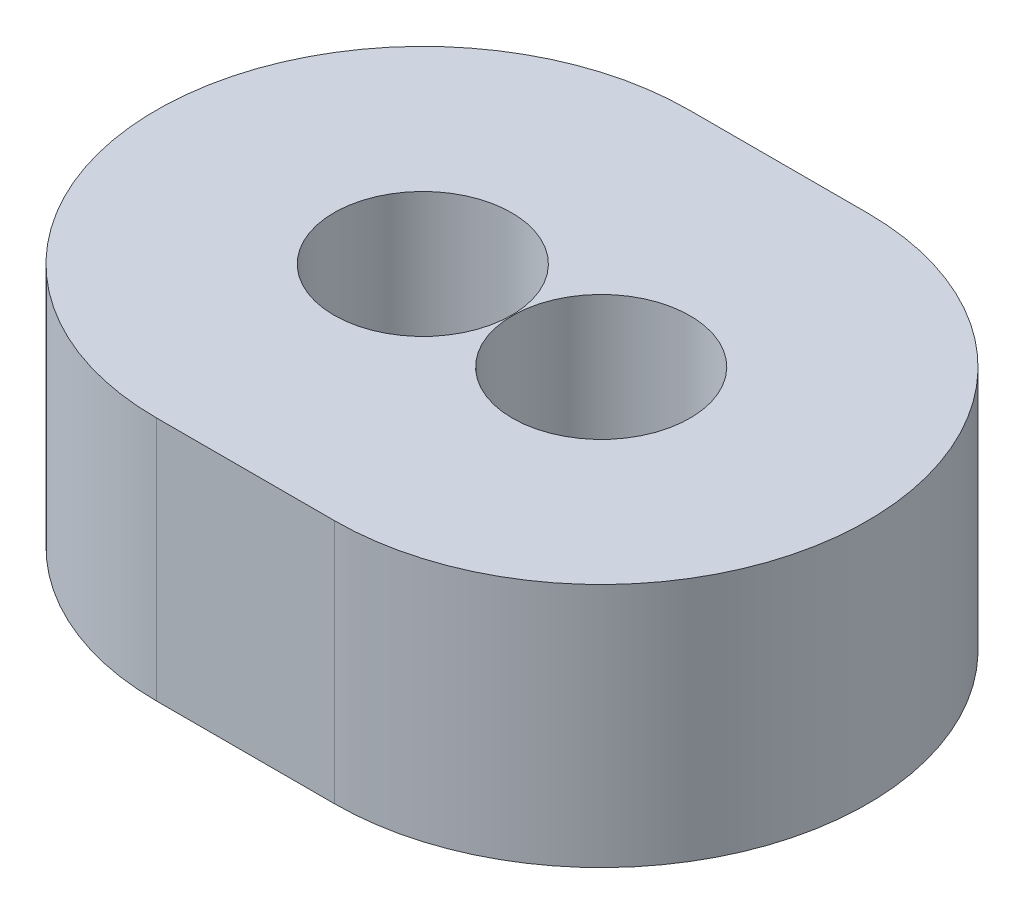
SolidWorks part; units mm, degrees
ref_plane "Front Plane" through (0, 0, 0) normal (0, 0, 1) x (1, 0, 0)
ref_plane "Top Plane" through (0, 0, 0) normal (0, 1, 0) x (1, 0, 0)
ref_plane "Right Plane" through (0, 0, 0) normal (1, 0, 0) x (0, 0, -1)
sketch "Sketch1" plane through (0, 0, 0) normal (0, 1, 0) x (1, 0, 0)
  line L0 (-3.1877, 0) -> (3.1877, 0) construction
  line L1 (-3.1877, 9.525) -> (3.1877, 9.525)
  line L2 (-3.1877, -9.525) -> (3.1877, -9.525)
  arc A0 (-3.1877, 9.525) -> (-3.1877, -9.525) centre (-3.1877, 0) ccw
  arc A1 (3.1877, -9.525) -> (3.1877, 9.525) centre (3.1877, 0) ccw
  circle A2 centre (-3.1877, 0) radius 3.175
  circle A3 centre (3.1877, 0) radius 3.175
  point P2 (0, 0)
extrude "Boss-Extrude1" add sketch "Sketch1" along normal blind 8.763
